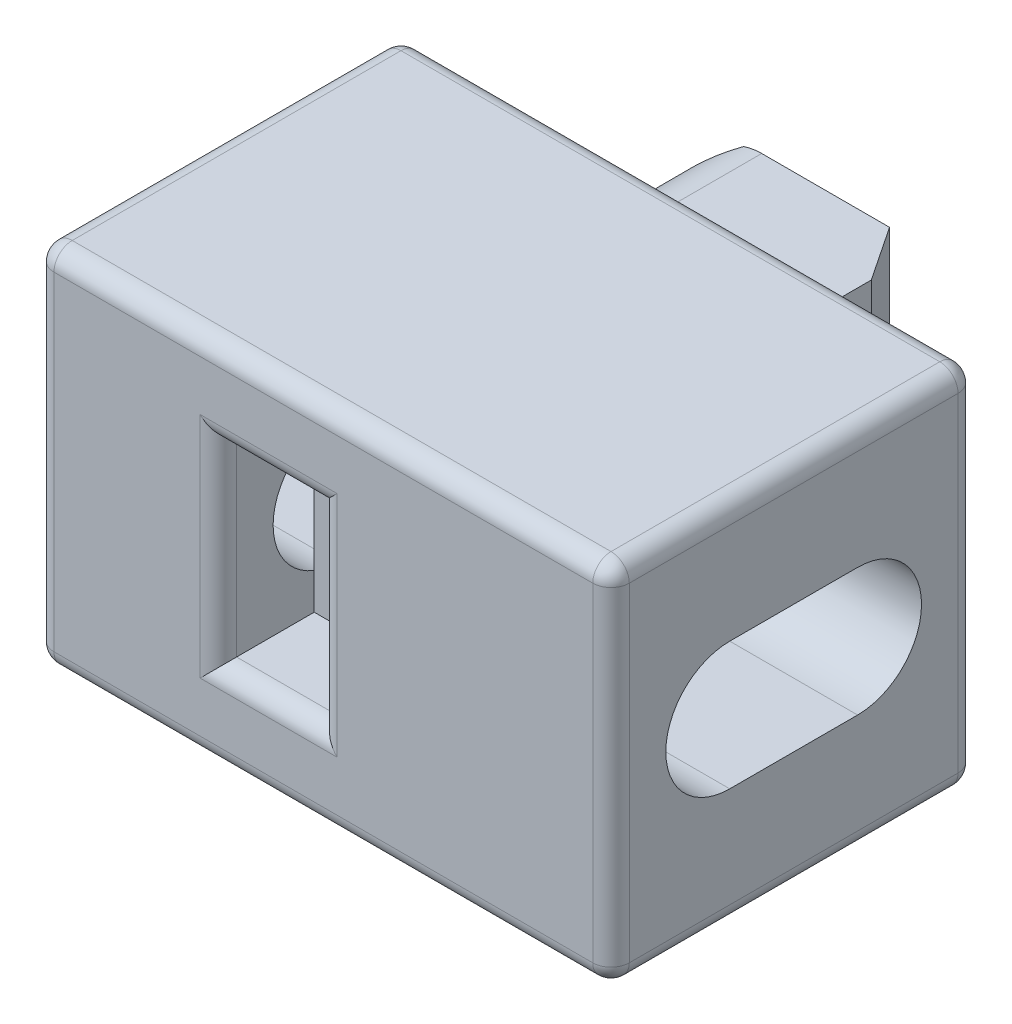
SolidWorks part; units mm, degrees
ref_plane "Front Plane" through (0, 0, 0) normal (0, 0, 1) x (1, 0, 0)
ref_plane "Top Plane" through (0, 0, 0) normal (0, 1, 0) x (1, 0, 0)
ref_plane "Right Plane" through (0, 0, 0) normal (1, 0, 0) x (0, 0, -1)
imported_body "1.3044 Paneelikiinnike C45 harmaa.stp"
fillet "Fillet1" radius 1
